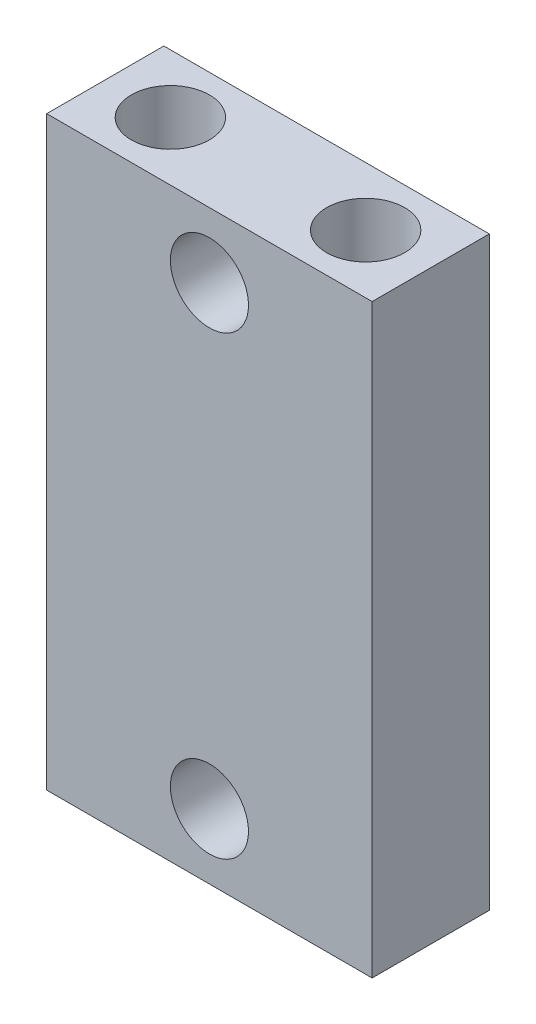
SolidWorks part; units mm, degrees
ref_plane "Front Plane" through (0, 0, 0) normal (0, 0, 1) x (1, 0, 0)
ref_plane "Top Plane" through (0, 0, 0) normal (0, 1, 0) x (1, 0, 0)
ref_plane "Right Plane" through (0, 0, 0) normal (1, 0, 0) x (0, 0, -1)
sketch "Sketch1" plane through (0, 0, 0) normal (0, 1, 0) x (1, 0, 0)
  line L1 (0, 0) -> (12.7, 0)
  line L2 (0, 0) -> (0, 4.572)
  line L3 (0, 4.572) -> (12.7, 4.572)
  line L4 (12.7, 0) -> (12.7, 4.572)
  dimension "D1" = 4.572
  dimension "D2" = 12.7
extrude "Boss-Extrude1" add sketch "Sketch1" along normal blind 22.86
sketch "Sketch2" plane through (0, 22.86, 0) normal (0, 1, 0) x (1, 0, 0)
  line L0 (0, 4.572) -> (0, 0) construction
  line L1 (0, 0) -> (12.7, 0) construction
  circle A0 centre (2.54, 2.286) radius 1.524
  circle A1 centre (10.16, 2.286) radius 1.524
  dimension "D5" = 3.048
  dimension "D6" = 3.048
  dimension "D1" = 2.54
  dimension "D2" = 7.62
  dimension "D3" = 2.286
  dimension "D4" = 2.286
extrude "Cut-Extrude1" cut sketch "Sketch2" against normal blind 7.62
sketch "Sketch3" plane through (0, 0, 0) normal (0, 0, 1) x (1, 0, 0)
  line L0 (0, 22.86) -> (0, 0) construction
  line L1 (0, 22.86) -> (12.7, 22.86) construction
  line L2 (12.7, 0) -> (0, 0) construction
  circle A0 centre (6.35, 20.32) radius 1.524
  circle A1 centre (6.35, 2.54) radius 1.524
  dimension "D3" = 3.048
  dimension "D4" = 3.048
  dimension "D1" = 6.35
  dimension "D2" = 2.54
  dimension "D5" = 2.54
extrude "Cut-Extrude2" cut sketch "Sketch3" against normal through all
